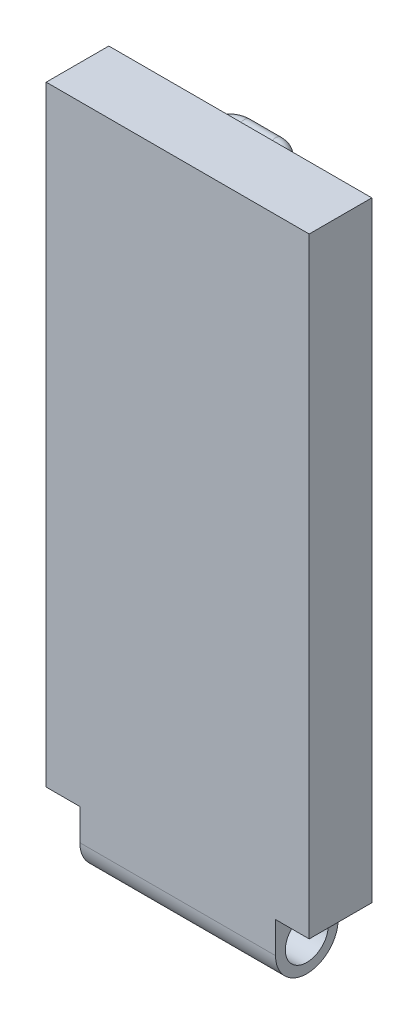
SolidWorks part; units mm, degrees
ref_plane "前视基准面" through (0, 0, 0) normal (0, 0, 1) x (1, 0, 0)
ref_plane "上视基准面" through (0, 0, 0) normal (0, 1, 0) x (1, 0, 0)
ref_plane "右视基准面" through (0, 0, 0) normal (1, 0, 0) x (0, 0, -1)
sketch "草图1" plane through (0, 0, 0) normal (0, 0, 1) x (1, 0, 0)
  line L1 (0, 0) -> (33.6, 0)
  line L2 (0, 0) -> (0, 78)
  line L3 (0, 78) -> (33.6, 78)
  line L4 (33.6, 0) -> (33.6, 78)
  dimension "D1" = 33.6
  dimension "D2" = 78
extrude "凸台-拉伸1" add sketch "草图1" against normal blind 8
ref_plane "基准面1" through (16.8, 0, 0) normal (1, 0, 0) x (0, 0, -1)
sketch "草图2" plane through (16.8, 0, 0) normal (-1, 0, 0) x (0, 0, 1)
  line L0 (0, 78) -> (0, 0) construction
  line L1 (-8, 0) -> (0, 0)
  line L2 (-8, 0) -> (-8, -4)
  line L4 (0, 0) -> (0, -4)
  line L5 (0, 0) -> (-8, -8) construction
  arc A0 (-8, -4) -> (0, -4) centre (-4, -4) ccw
  circle A1 centre (-4, -4) radius 2.75
  dimension "D2" = 4
  dimension "D3" = 5.5
  dimension "D1" = 8
extrude "凸台-拉伸4" add sketch "草图2" along normal mid plane 25
sketch "草图3" plane through (0, 0, -8) normal (0, 0, -1) x (-1, 0, 0)
  line L0 (-12.8, 75) -> (-12.8, 73) construction
  line L1 (-11.8, 75) -> (-11.8, 73)
  line L2 (-13.8, 75) -> (-13.8, 73)
  line L3 (-16.8, 78) -> (-16.8, 6.5913) construction
  line L4 (-33.6, 78) -> (0, 78) construction
  arc A0 (-11.8, 75) -> (-13.8, 75) centre (-12.8, 75) ccw
  arc A1 (-13.8, 73) -> (-11.8, 73) centre (-12.8, 73) ccw
  point P2 (-12.8, 74)
  dimension "D2" = 1
  dimension "D1" = 2
  dimension "D3" = 8
  dimension "D4" = 4
ref_plane "基准面2" through (0, 74, 0) normal (0, 1, 0) x (1, 0, 0)
sketch "草图4" plane through (0, 74, 0) normal (0, 1, 0) x (1, 0, 0)
  line L0 (33.6, 8) -> (0, 8) construction
  line L1 (16.8, 6.3547) -> (16.8, 17.3797) construction
  line L2 (12.8, 8) -> (12.8, 8.5)
  line L3 (14.8, 10.5) -> (18.8, 10.5)
  line L5 (20.8, 8.5) -> (20.8, 8)
  arc A0 (18.8, 10.5) -> (20.8, 8.5) centre (18.8, 8.5) cw
  arc A1 (12.8, 8.5) -> (14.8, 10.5) centre (14.8, 8.5) cw
  point P0 (16.8, 8)
  point P14 (12.8, 10.5)
  dimension "D2" = 2
  dimension "D1" = 2.5
sweep "扫描1" add profiles "草图3" path "草图4"
